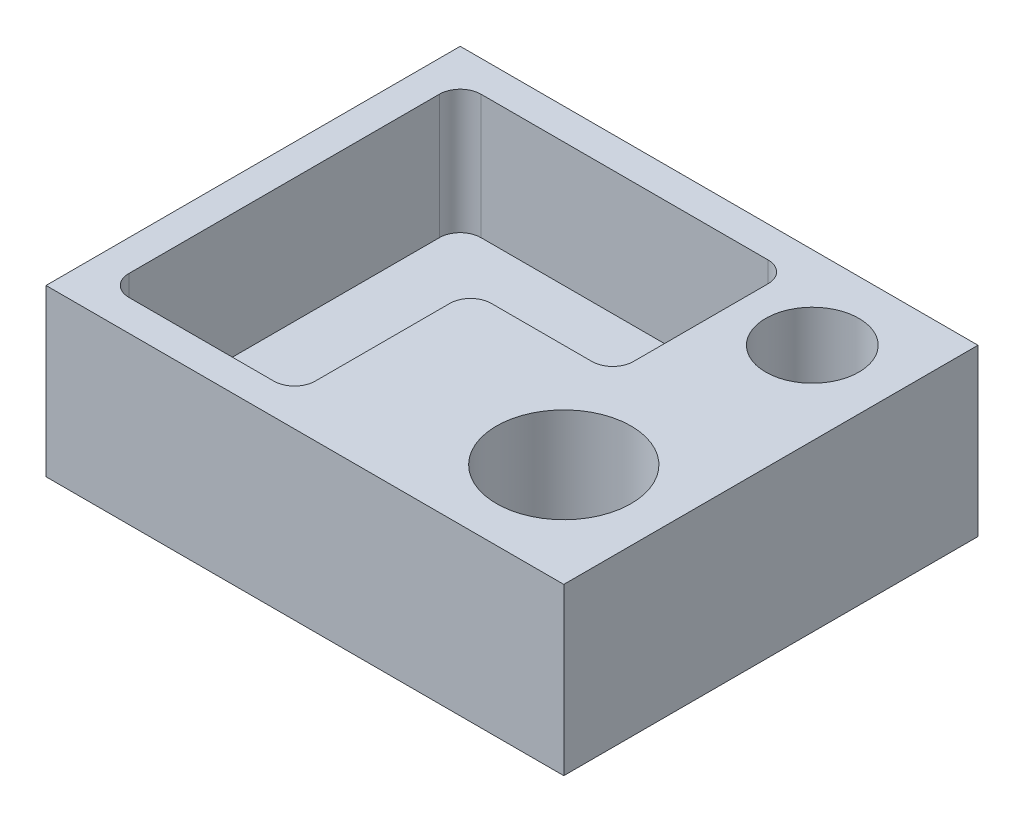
SolidWorks part; units mm, degrees
ref_plane "Front Plane" through (0, 0, 0) normal (0, 0, 1) x (1, 0, 0)
ref_plane "Top Plane" through (0, 0, 0) normal (0, 1, 0) x (1, 0, 0)
ref_plane "Right Plane" through (0, 0, 0) normal (1, 0, 0) x (0, 0, -1)
sketch "Sketch1" plane through (0, 0, 0) normal (0, 1, 0) x (1, 0, 0)
  line L1 (125, -100) -> (-125, -100)
  line L2 (125, -100) -> (125, 100)
  line L3 (125, 100) -> (-125, 100)
  line L4 (-125, -100) -> (-125, 100)
  line L5 (125, -100) -> (-125, 100) construction
  line L6 (125, 100) -> (-125, -100) construction
  point P0 (0, 0)
  dimension "D1" = 250
  dimension "D2" = 200
extrude "Boss-Extrude1" add sketch "Sketch1" along normal blind 80
sketch "Sketch2" plane through (0, 80, 0) normal (0, 1, 0) x (1, 0, 0)
  line L0 (-125, -100) -> (125, -100) construction
  line L1 (-20, 85) -> (-110, 85)
  line L2 (-20, 0) -> (-20, -85)
  line L3 (-20, -85) -> (-110, -85)
  line L4 (-110, 85) -> (-110, -85)
  line L5 (-20, 85) -> (-110, -85) construction
  line L6 (-20, -85) -> (-110, 85) construction
  line L7 (-125, 100) -> (-125, -100) construction
  line L8 (125, 100) -> (-125, 100) construction
  line L10 (125, -100) -> (125, 100) construction
  line L11 (9.0887, 0) -> (180.6456, 0) construction
  line L12 (-20, 85) -> (48.6207, 85)
  line L13 (48.6207, 85) -> (48.6207, 0)
  line L14 (48.6207, 0) -> (-20, 0)
  circle A0 centre (85, 60) radius 22.5
  circle A1 centre (75, -50) radius 32.5
  point P0 (-65, 0)
  dimension "D5" = 45
  dimension "D8" = 65
  dimension "D1" = 90
  dimension "D2" = 170
  dimension "D3" = 15
  dimension "D4" = 15
  dimension "D6" = 40
  dimension "D7" = 40
  dimension "D9" = 50
  dimension "D10" = 50
extrude "Cut-Extrude1" cut sketch "Sketch2" against normal blind 60
fillet "Fillet1" radius 10 6 edges at (-20, 50, 85) (-110, 50, 85) (-110, 50, -85) (-20, 50, 0) (48.6207, 50, 0) (48.6207, 50, -85)
